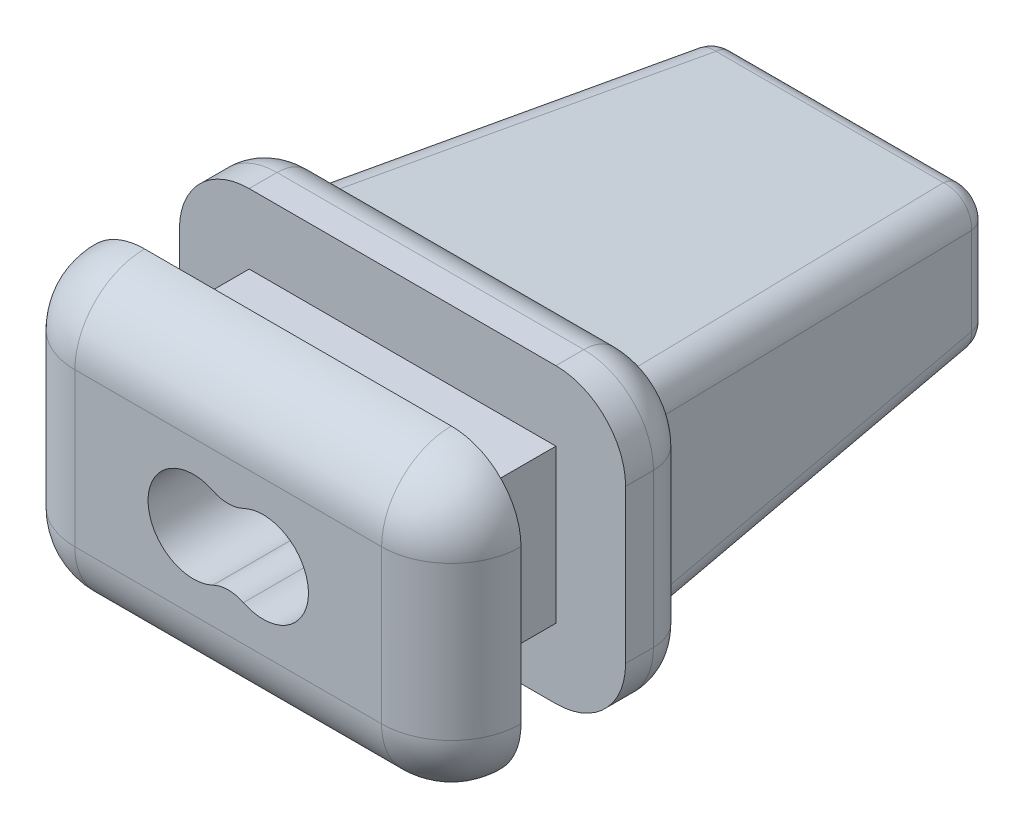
SolidWorks part; units mm, degrees
ref_plane "Front Plane" through (0, 0, 0) normal (0, 0, 1) x (1, 0, 0)
ref_plane "Top Plane" through (0, 0, 0) normal (0, 1, 0) x (1, 0, 0)
ref_plane "Right Plane" through (0, 0, 0) normal (1, 0, 0) x (0, 0, -1)
imported_body "Imported3"
hole_wizard "Hole1" positions "Sketch2" profile "Sketch1" legacy
sketch "Sketch2" plane through (0, 0, -7.9) normal (0, 0, -1) x (-1, 0, 0)
  point P0 (0.5, 0)
  point P1 (-0.5, 0)
sketch "Sketch1" plane through (-0.5, 0, -7.9) normal (1, 0, 0) x (0, 1, 0)
  line L0 (0, 0) -> (0, 8.9)
  line L1 (0, 8.9) -> (0.65, 8.9)
  line L2 (0.65, 8.9) -> (0.65, 0)
  line L3 (0.65, 0) -> (0, 0)
  line L4 (0, 110) -> (0, -10) construction
  dimension "Diameter" = 1.3
  dimension "Depth" = 8.9
fillet "Fillet1" radius 0.4 4 edges at (2.3014, -1.2511, -5.1878) (2.3014, 1.2511, -5.1878) (-2.3014, -1.2511, -5.1878) (-2.3014, 1.2511, -5.1878)
fillet "Fillet2" radius 0.3 8 edges at (-2, 0, -7.9) (-1.8836, -0.8838, -7.9) (-1.8836, 0.8838, -7.9) (0, -1, -7.9) (0, 1, -7.9) (1.8836, -0.8838, -7.9) (1.8836, 0.8838, -7.9) (2, 0, -7.9)
fillet "Fillet3" radius 0.5 2 edges at (0, 0.4153, -3.45) (0, -0.4153, -3.45)
